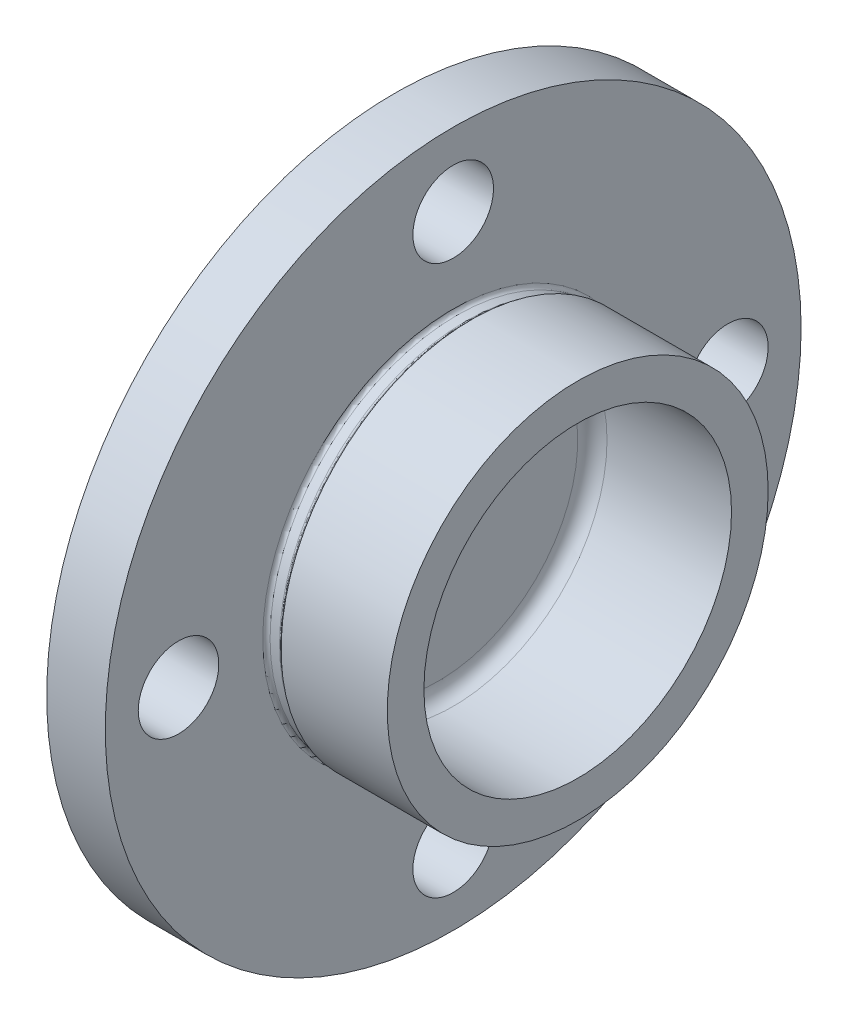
SolidWorks part; units mm, degrees
ref_plane "Спереди" through (0, 0, 0) normal (0, 0, 1) x (1, 0, 0)
ref_plane "Сверху" through (0, 0, 0) normal (0, 1, 0) x (1, 0, 0)
ref_plane "Справа" through (0, 0, 0) normal (1, 0, 0) x (0, 0, -1)
sketch "Sketch2" plane through (0, 0, 0) normal (0, 0, 1) x (1, 0, 0)
  line L0 (29.907, 0) -> (-13.6718, 0) construction
  line L1 (0, 0) -> (0, 47.5)
  line L2 (0, 47.5) -> (8, 47.5)
  line L3 (8, 47.5) -> (8, 26)
  line L4 (8, 26) -> (25, 26)
  line L5 (25, 26) -> (25, 0)
  line L6 (25, 0) -> (0, 0)
  line L7 (25, 21) -> (6, 21)
  line L8 (6, 21) -> (6, 0)
  dimension "D1" = 52
  dimension "D2" = 95
  dimension "D3" = 25
  dimension "D4" = 8
  dimension "D5" = 6
  dimension "D6" = 5
revolve "Revolve1" add sketch "Sketch2" angle 360 about L0
sketch "Sketch3" plane through (0, 0, 0) normal (0, 0, 1) x (1, 0, 0)
  line L0 (36.0506, 0) -> (-7.0675, 0) construction
  line L1 (8, 26) -> (8, 25.5)
  line L2 (8, -26) -> (8, 26) construction
  line L3 (8, 25.5) -> (10, 25.5)
  line L4 (10, 25.5) -> (10.5, 26)
  line L5 (25, 26) -> (8, 26) construction
  line L6 (10.5, 26) -> (8, 26)
  dimension "D1" = 0.5
  dimension "D2" = 45
  dimension "D3" = 2
revolve "Cut-Revolve1" cut sketch "Sketch3" angle 360 about L0
sketch "Sketch4" plane through (0, 0, 0) normal (0, 0, 1) x (1, 0, 0)
  line L0 (36.4193, 0) -> (-12.5822, 0) construction
  line L1 (0, 0) -> (0, 27.5)
  line L2 (0, 47.5) -> (0, -47.5) construction
  line L3 (0, 27.5) -> (2, 27.5)
  line L4 (2, 27.5) -> (2, 0)
  line L5 (2, 0) -> (0, 0)
  dimension "D1" = 2
  dimension "D2" = 55
revolve "Cut-Revolve2" cut sketch "Sketch4" angle 360 about L0
fillet "Fillet1" radius 2 1 edges at (6, 0, -21)
fillet "Fillet2" radius 0.5 2 edges at (8, 0, -25.5) (10, 0, -25.5)
fillet "Fillet3" radius 2 1 edges at (2, 0, -27.5)
sketch "Sketch5" plane through (0, 0, 0) normal (-1, 0, 0) x (0, 0, 1)
  line L0 (0, 53.9829) -> (0, -55.9282) construction
  circle A0 centre (0, 0) radius 37.5 construction
  circle A1 centre (0, 37.5) radius 5.5
  circle A2 centre (37.5, 0) radius 5.5
  circle A3 centre (0, -37.5) radius 5.5
  circle A4 centre (-37.5, 0) radius 5.5
  dimension "D1" = 75
  dimension "D2" = 11
extrude "Cut-Extrude1" cut sketch "Sketch5" against normal up to next
